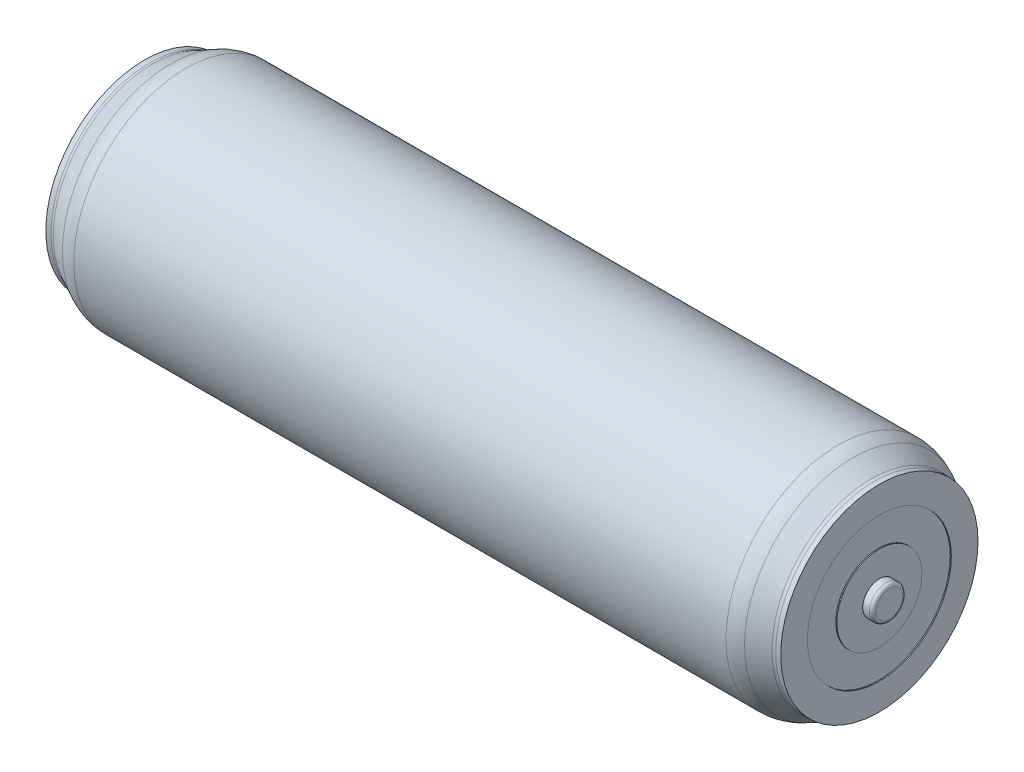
SolidWorks part; units mm, degrees
ref_plane "Plan de face" through (0, 0, 0) normal (0, 0, 1) x (1, 0, 0)
ref_plane "Plan de dessus" through (0, 0, 0) normal (0, 1, 0) x (1, 0, 0)
ref_plane "Plan de droite" through (0, 0, 0) normal (1, 0, 0) x (0, 0, -1)
sketch "Esquisse1" plane through (0, 0, 0) normal (0, 0, 1) x (1, 0, 0)
  line L0 (124.5159, 0) -> (-43.1128, 0) construction
  line L1 (0, 14.75) -> (0.7639, 14.75)
  line L2 (0, 0) -> (111.4, 0)
  line L3 (0, 0) -> (0, 2.5)
  line L4 (6.1803, 16.75) -> (103.7197, 16.75)
  line L5 (111.4, 0) -> (111.4, 2)
  line L6 (1.2111, 14.8556) -> (3.9443, 16.2221)
  line L7 (110.9, 2.5) -> (109.9, 2.5)
  line L8 (109.9, 2.5) -> (109.9, 6.3576)
  line L9 (109.9, 14.75) -> (109.1361, 14.75)
  line L10 (108.6889, 14.8556) -> (105.9557, 16.2221)
  line L11 (109.9, 10.7609) -> (109.9, 14.75)
  line L12 (109.9, 10.7609) -> (109.7463, 10.7609)
  line L13 (0, 10.7609) -> (0, 14.75)
  line L14 (109.9, 6.3576) -> (109.7463, 6.3576)
  line L15 (109.7463, 10.7609) -> (109.7463, 6.3576)
  line L16 (0, 10.7609) -> (0.1444, 10.7609)
  line L17 (0, 4.4517) -> (0, 6.3576)
  line L18 (0, 6.3576) -> (0.1444, 6.3576)
  line L19 (0.1444, 10.7609) -> (0.1444, 6.3576)
  line L20 (0, 2.5) -> (0.1444, 2.5)
  line L22 (0, 4.4517) -> (0.1444, 4.4517)
  line L23 (0.1444, 2.5) -> (0.1444, 4.4517)
  arc A0 (3.9443, 16.2221) -> (6.1803, 16.75) centre (6.1803, 11.75) cw
  arc A1 (0.7639, 14.75) -> (1.2111, 14.8556) centre (0.7639, 15.75) ccw
  arc A2 (109.1361, 14.75) -> (108.6889, 14.8556) centre (109.1361, 15.75) cw
  arc A3 (110.9, 2.5) -> (111.4, 2) centre (110.9, 2) cw
  arc A4 (105.9557, 16.2221) -> (103.7197, 16.75) centre (103.7197, 11.75) ccw
  point P11 (5, 16.75)
  point P14 (1, 14.75)
  point P21 (108.9, 14.75)
  point P26 (104.9, 16.75)
  dimension "D6" = 5
  dimension "D7" = 1
  dimension "D13" = 1
  dimension "D14" = 5
  dimension "D15" = 0.5
  dimension "D1" = 111.4
  dimension "D2" = 16.75
  dimension "D3" = 5
  dimension "D4" = 2
  dimension "D5" = 1
  dimension "D8" = 1.5
  dimension "D9" = 1
  dimension "D10" = 4
  dimension "D11" = 2
  dimension "D12" = 2.5
revolve "Révolution1" add sketch "Esquisse1" angle 360 about L0
